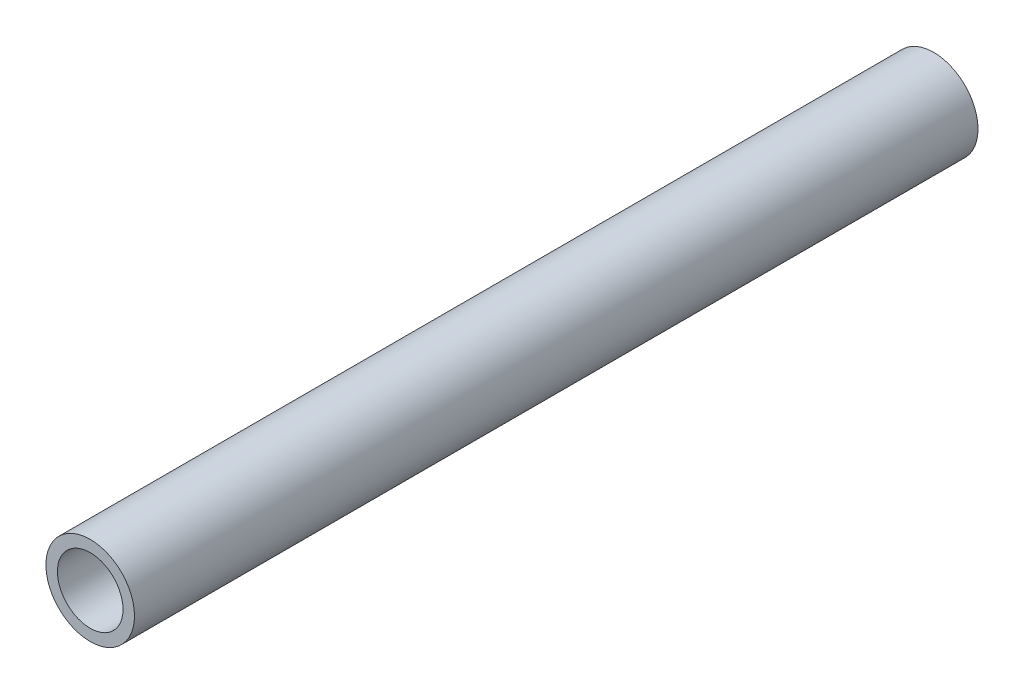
SolidWorks part; units mm, degrees
ref_plane "Front" through (0, 0, 0) normal (0, 0, 1) x (1, 0, 0)
ref_plane "Top" through (0, 0, 0) normal (0, 1, 0) x (1, 0, 0)
ref_plane "Right" through (0, 0, 0) normal (1, 0, 0) x (0, 0, -1)
sketch "Sketch1" plane through (0, 0, 0) normal (0, 0, 1) x (1, 0, 0)
  circle A0 centre (0, 0) radius 10.668
  circle A1 centre (0, 0) radius 7.8994
  dimension "D1" = 21.336
  dimension "D2" = 15.7988
extrude "Boss-Extrude1" add sketch "Sketch1" along normal mid plane 203.2
sketch "Sketch2" plane through (0, 0, 0) normal (0, 1, 0) x (1, 0, 0)
  line L0 (-10.668, -101.6) -> (10.668, -101.6) construction
  line L1 (-65.9752, 73.025) -> (58.3731, 73.025) construction
  line L2 (58.3731, -73.025) -> (-65.9752, -73.025) construction
  line L3 (7.8994, 101.6) -> (-7.8994, 101.6) construction
  circle A0 centre (0, -69.85) radius 3.175
  circle A1 centre (0, -57.7342) radius 3.175
  circle A2 centre (0, -45.6184) radius 3.175
  circle A3 centre (0, -33.5026) radius 3.175
  circle A4 centre (0, -21.3868) radius 3.175
  circle A5 centre (0, -9.271) radius 3.175
  circle A6 centre (0, 2.8448) radius 3.175
  circle A7 centre (0, 14.9606) radius 3.175
  circle A8 centre (0, 27.0764) radius 3.175
  circle A9 centre (0, 39.1922) radius 3.175
  circle A10 centre (0, 51.308) radius 3.175
  circle A11 centre (0, 63.4238) radius 3.175
  dimension "D1" = 6.35
  dimension "D2" = 31.75
  dimension "D6" = 9.6012
  dimension "D3" = 28.575
  dimension "D4" = 28.575
  dimension "D5" = 12
extrude "Cut-Extrude1" cut sketch "Sketch2" against normal blind 25.4
